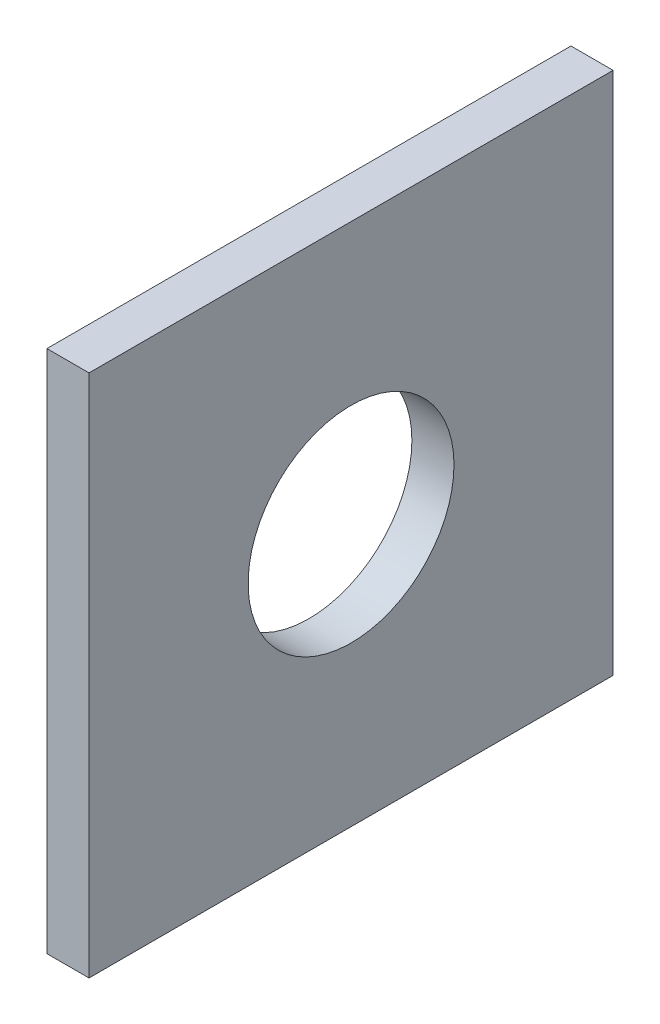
SolidWorks part; units mm, degrees
ref_plane "Plane1" through (0, 0, 0) normal (0, 0, 1) x (1, 0, 0)
ref_plane "Plane2" through (0, 0, 0) normal (0, 1, 0) x (1, 0, 0)
ref_plane "Plane3" through (0, 0, 0) normal (1, 0, 0) x (0, 0, -1)
other "Configuration Table"
sketch "Sketch1" plane through (0, 0, 0) normal (1, 0, 0) x (0, 0, -1)
  line L0 (-44.45, 0) -> (41.275, 0) construction
  line L1 (-28, -28) -> (28, -28)
  line L2 (-28, -28) -> (-28, 28)
  line L3 (-28, 28) -> (28, 28)
  line L4 (28, -28) -> (28, 28)
  line L5 (0, 41.275) -> (0, -38.1) construction
  circle A0 centre (0, 0) radius 11
  dimension "Inside_dia" = 22
  dimension "Outside_dia" = 56
extrude "Body" add sketch "Sketch1" against normal blind 4.5
